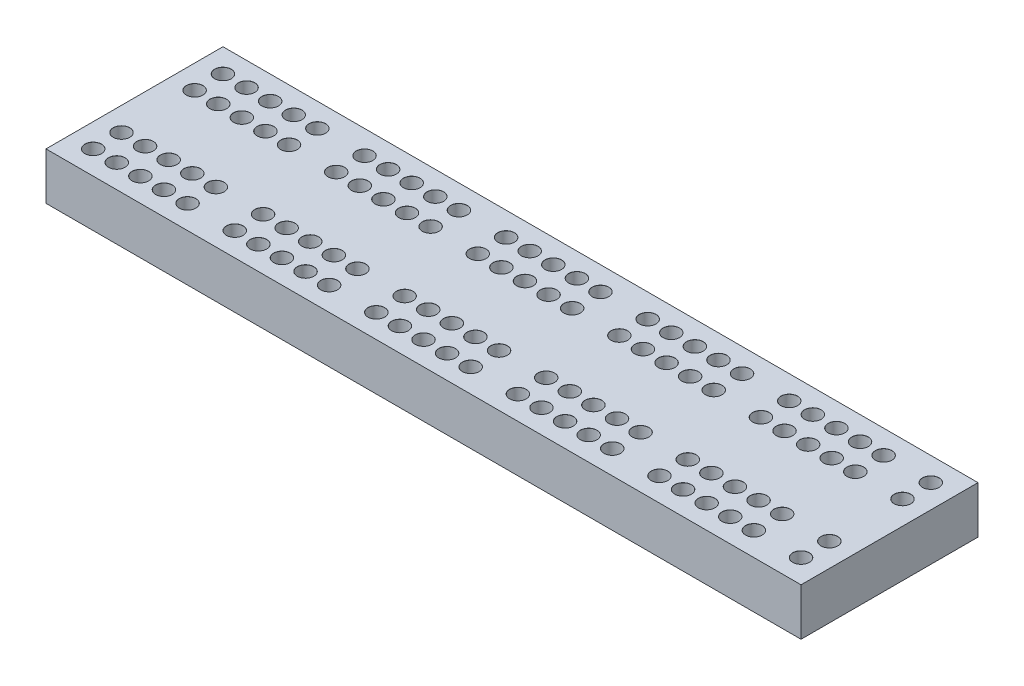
SolidWorks part; units mm, degrees
ref_plane "Alzado" through (0, 0, 0) normal (0, 0, 1) x (1, 0, 0)
ref_plane "Planta" through (0, 0, 0) normal (0, 1, 0) x (1, 0, 0)
ref_plane "Vista lateral" through (0, 0, 0) normal (1, 0, 0) x (0, 0, -1)
sketch "Sketch1" plane through (0, 0, 0) normal (0, 1, 0) x (1, 0, 0)
  line L1 (-160, -37.5) -> (160, -37.5)
  line L2 (-160, -37.5) -> (-160, 37.5)
  line L3 (-160, 37.5) -> (160, 37.5)
  line L4 (160, -37.5) -> (160, 37.5)
  line L5 (-160, -37.5) -> (160, 37.5) construction
  line L6 (-160, 37.5) -> (160, -37.5) construction
  point P0 (0, 0)
  dimension "D1" = 320
  dimension "D2" = 75
extrude "Boss-Extrude1" add sketch "Sketch1" along normal blind 20
sketch "Sketch2" plane through (0, 20, 0) normal (0, 1, 0) x (1, 0, 0)
  line L0 (-160, 37.5) -> (-160, -37.5) construction
  line L1 (160, 37.5) -> (-160, 37.5) construction
  point P0 (-150, 27.5)
  point P5 (-193.6773, 36.3262)
  dimension "D1" = 10
  dimension "D2" = 10
hole_wizard "Ø7.0 (7) Diameter Hole1" positions "Sketch3" profile "Sketch4" hole size "Ø7.0" standard "DIN"
sketch "Sketch3" plane through (0, 20, 0) normal (0, 1, 0) x (1, 0, 0)
  point P0 (-150, 27.5)
sketch "Sketch4" plane through (-150, 20, -27.5) normal (1, 0, 0) x (0, 0, 1)
  line L0 (0, 0) -> (0, 14.103)
  line L1 (0, 14.103) -> (3.5, 12)
  line L2 (3.5, 12) -> (3.5, 0.025)
  line L3 (3.5, 0.025) -> (3.525, 0)
  line L5 (3.525, 0) -> (0, 0)
  line L6 (-3.5, 0.025) -> (-3.525, 0) construction
  line L10 (0, 14.103) -> (-3.5, 12) construction
  line L11 (0, -6.35) -> (0, 107.95) construction
  dimension "Hole Dia." = 7
  dimension "Hole Depth" = 12
  dimension "Near C'Sink Dia." = 7.05
  dimension "Near C'Sink Angle" = 90
  dimension "Drill Angle" = 118
pattern_linear "LPattern1" count 2 spacing 12 along (0, 0, 1) count 5 spacing 10 along (1, 0, 0) of "Ø7.0 (7) Diameter Hole1"
pattern_linear "LPattern3" count 5 spacing 60 along (1, 0, 0) of "LPattern1", "Ø7.0 (7) Diameter Hole1"
pattern_linear "LPattern4" count 2 spacing 300 along (1, 0, 0) count 2 spacing 12 along (0, 0, 1) of "Ø7.0 (7) Diameter Hole1"
mirror "Mirror2" about plane through (0, 0, 0) normal (0, 0, 1) of "LPattern4", "LPattern3", "LPattern1", "Ø7.0 (7) Diameter Hole1"
